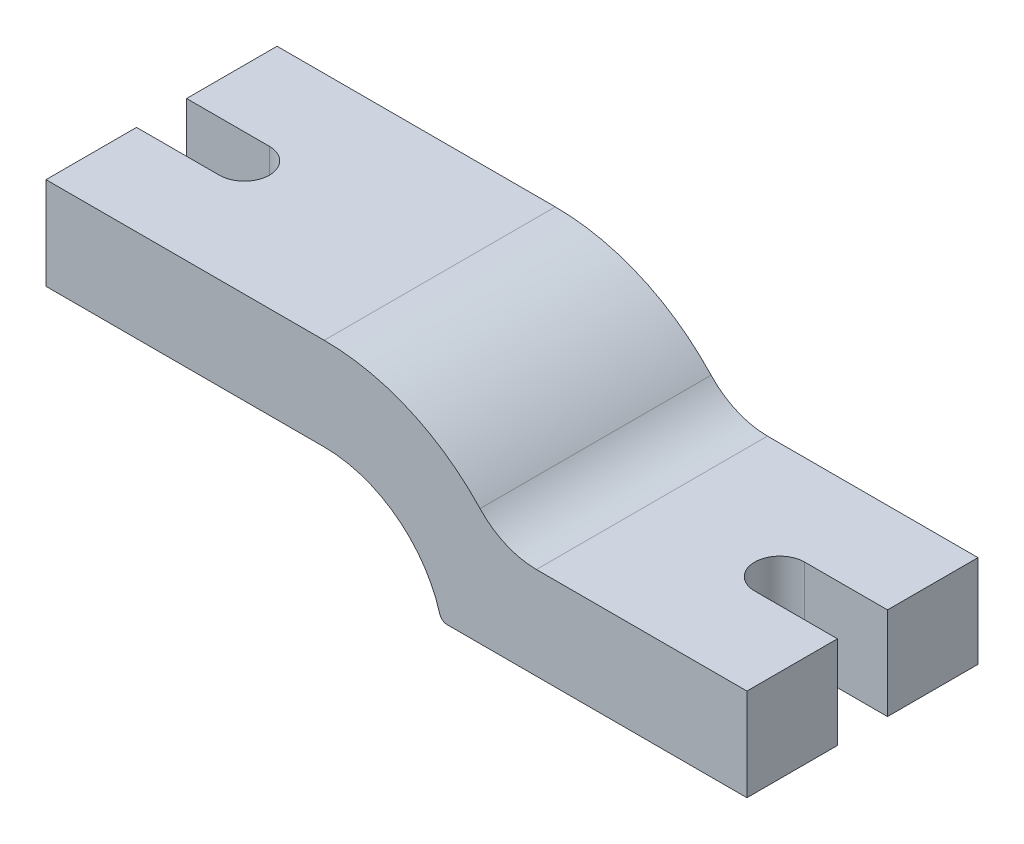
SolidWorks part; units mm, degrees
ref_plane "Plan de face" through (0, 0, 0) normal (0, 0, 1) x (1, 0, 0)
ref_plane "Plan de dessus" through (0, 0, 0) normal (0, 1, 0) x (1, 0, 0)
ref_plane "Plan de droite" through (0, 0, 0) normal (1, 0, 0) x (0, 0, -1)
sketch "Esquisse1" plane through (0, 0, 0) normal (0, 0, 1) x (1, 0, 0)
  line L0 (0, 15.625) -> (-36.12, 15.625)
  line L1 (-36.12, 15.625) -> (-36.12, 27.625)
  line L2 (-36.12, 27.625) -> (0, 27.625)
  line L3 (54.8787, 15.625) -> (54.8787, 3.625)
  line L4 (54.8787, 3.625) -> (15.1987, 3.625)
  line L5 (22.7816, 15.625) -> (54.8787, 15.625)
  arc A0 (15.1987, 3.625) -> (0, 15.625) centre (0, 0) ccw
  arc A1 (22.7816, 15.625) -> (0, 27.625) centre (0, 0) ccw
  dimension "D1" = 31.25
  dimension "D4" = 12
  dimension "D2" = 39.68
  dimension "D3" = 36.12
  dimension "D5" = 12
  dimension "D6" = 24
extrude "Boss.-Extru.1" add sketch "Esquisse1" along normal blind 30
fillet "Congé1" radius 10 1 edges at (22.7816, 15.625, 15)
fillet "Congé2" radius 1 1 edges at (15.1987, 3.625, 15)
sketch "Esquisse2" plane through (0, 27.625, 0) normal (0, 1, 0) x (1, 0, 0)
  line L0 (-36.12, -15) -> (54.8787, -15) construction
  line L1 (-36.12, -30) -> (-36.12, 0) construction
  line L2 (54.8787, -30) -> (54.8787, 0) construction
  line L3 (-36.12, -15) -> (-25.37, -15) construction
  line L4 (-36.12, -11.75) -> (-25.37, -11.75)
  line L5 (-36.12, -18.25) -> (-25.37, -18.25)
  line L6 (54.8787, -15) -> (44.1287, -15) construction
  line L7 (54.8787, -18.25) -> (44.1287, -18.25)
  line L8 (54.8787, -11.75) -> (44.1287, -11.75)
  arc A0 (-36.12, -11.75) -> (-36.12, -18.25) centre (-36.12, -15) ccw
  arc A1 (-25.37, -18.25) -> (-25.37, -11.75) centre (-25.37, -15) ccw
  arc A2 (54.8787, -18.25) -> (54.8787, -11.75) centre (54.8787, -15) ccw
  arc A3 (44.1287, -11.75) -> (44.1287, -18.25) centre (44.1287, -15) ccw
  point P6 (-30.745, -15)
  point P12 (49.5037, -15)
  dimension "D1" = 3.25
  dimension "D2" = 3.25
  dimension "D3" = 10.75
  dimension "D4" = 10.75
extrude "Enlèv. mat.-Extru.1" cut sketch "Esquisse2" against normal through all
